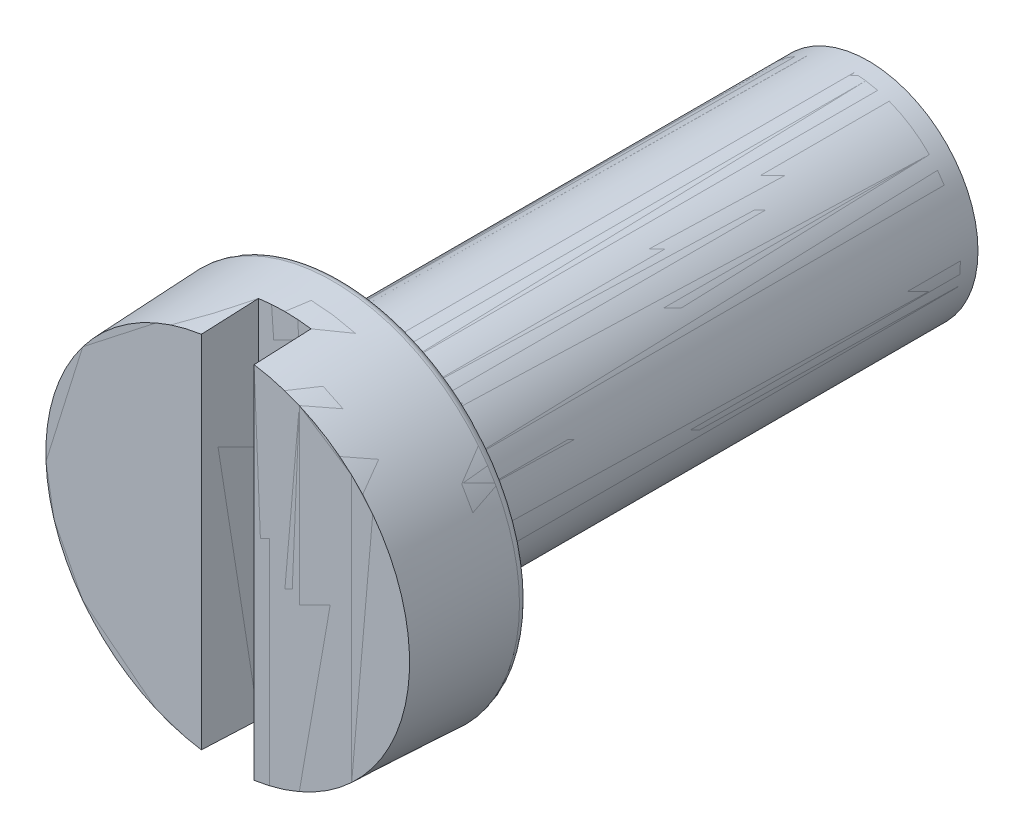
SolidWorks part; units mm, degrees
ref_plane "Plan1" through (0, 0, 0) normal (0, 0, 1) x (1, 0, 0)
ref_plane "Plan2" through (0, 0, 0) normal (0, 1, 0) x (1, 0, 0)
ref_plane "Plan3" through (0, 0, 0) normal (1, 0, 0) x (0, 0, -1)
imported_body "Vis tête cylindrique fendue DIN 84 - M5x12 - 4,8"
chamfer "Chanfrein1" distance 0.4 angle 45
